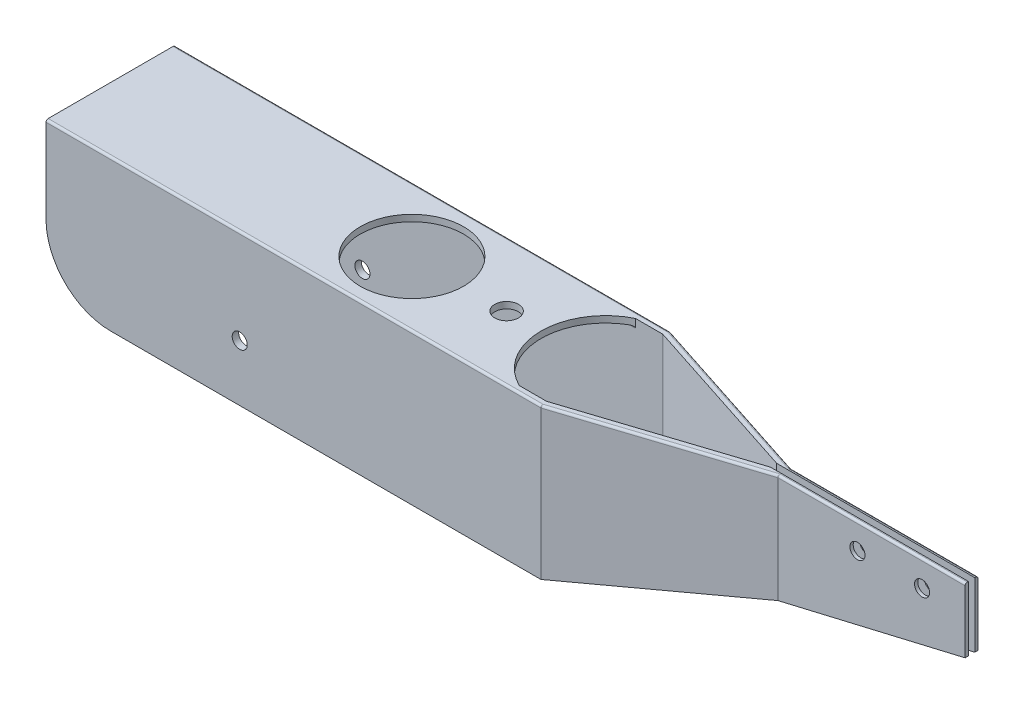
SolidWorks part; units mm, degrees
ref_plane "Front Plane" through (0, 0, 0) normal (0, 0, 1) x (1, 0, 0)
ref_plane "Top Plane" through (0, 0, 0) normal (0, 1, 0) x (1, 0, 0)
ref_plane "Right Plane" through (0, 0, 0) normal (1, 0, 0) x (0, 0, -1)
sketch "Sketch1" plane through (0, 0, 0) normal (0, 1, 0) x (1, 0, 0)
  line L1 (0, 0) -> (200, 0)
  line L2 (0, 0) -> (0, 30)
  line L3 (0, 30) -> (200, 30)
  line L4 (200, 0) -> (200, 30)
  dimension "D1" = 30
  dimension "D2" = 200
extrude "Extrude1" add sketch "Sketch1" along normal blind 35
sketch "Sketch2" plane through (0, 35, 0) normal (0, 1, 0) x (-1, 0, 0)
  line L0 (-200, -13.5) -> (0, -13.5) construction
  line L1 (-200, -13.5) -> (-156.5487, -13.5)
  line L2 (-115, 0) -> (-200, 0)
  line L3 (-115, 0) -> (-156.5487, -13.5)
  line L4 (-200, -15) -> (0, -15) construction
  line L5 (0, -30) -> (0, 0) construction
  line L6 (0, 0) -> (-200, 0) construction
  line L7 (-200, 0) -> (-200, -13.5)
  line L8 (-115, -30) -> (-200, -30)
  line L9 (-200, -30) -> (-200, -16.5)
  line L10 (-200, -16.5) -> (-156.5487, -16.5)
  line L11 (-115, -30) -> (-156.5487, -16.5)
  dimension "D1" = 18
extrude "Cut-Extrude1" cut sketch "Sketch2" against normal blind 35
shell "Shell1" thickness 1.5
fillet "Fillet1" radius 15 2 edges at (0, 0, -0.75) (0, 0, -29.25)
sketch "Sketch3" plane through (0, 35, 0) normal (0, 1, 0) x (-1, 0, 0)
  line L0 (-115, -30) -> (-115, 0) construction
  line L1 (0, 0) -> (-115, 0) construction
  line L2 (-200, -15.01) -> (-200, -14.99)
  line L5 (-114.7624, -28.5) -> (-156.2804, -15.01)
  line L6 (-114.7624, -1.5) -> (-156.2804, -14.99)
  line L9 (-200, -15.01) -> (-156.2804, -15.01)
  line L10 (-114.7624, -28.5) -> (-108.4617, -28.5)
  line L11 (-114.7624, -1.5) -> (-108.4617, -1.5)
  line L12 (-200, -14.99) -> (-156.2804, -14.99)
  arc A0 (-108.4617, -28.5) -> (-108.4617, -1.5) centre (-115, -15) ccw
extrude "Cut-Extrude2" cut sketch "Sketch3" against normal blind 35
sketch "Sketch4" plane through (0, 35, 0) normal (0, 1, 0) x (-1, 0, 0)
  circle A0 centre (-70, -15) radius 12
  circle A1 centre (-92, -15) radius 2.75
extrude "Cut-Extrude3" cut sketch "Sketch4" against normal blind 35
sketch "Sketch5" plane through (0, 0, 0) normal (0, 0, 1) x (1, 0, 0)
  line L0 (15, 0) -> (115, 0) construction
  circle A0 centre (45, 13.07) radius 1.75
  dimension "D1" = 13.07
extrude "Cut-Extrude4" cut sketch "Sketch5" against normal blind 35
sketch "Sketch6" plane through (0, 0, -13.5) normal (0, 0, 1) x (1, 0, 0)
  circle A0 centre (175, 29) radius 1.75
  circle A1 centre (190, 29) radius 1.75
extrude "Cut-Extrude5" cut sketch "Sketch6" against normal blind 35
fillet "Fillet2" radius 0.5 6 edges at (57.5, 35, 0) (135.7744, 35, -6.75) (178.2744, 35, -13.5) (178.2744, 35, -16.5) (135.7744, 35, -23.25) (57.5, 35, -30)
fillet "Fillet3" radius 0.5 4 edges at (156.5255, 34.8536, -16.3536) (114.9768, 34.8536, -29.8536) (156.5487, 17.25, -16.5) (115, 17.25, -30)
fillet "Fillet4" radius 0.5 4 edges at (156.5255, 34.8536, -13.6464) (114.9768, 34.8536, -0.1464) (156.5487, 17.25, -13.5) (115, 17.25, 0)
fillet "Fillet5" radius 0.5 4 edges at (114.7624, 17.5, -1.5) (54.2308, 33.5, -1.5) (54.2308, 33.5, -28.5) (114.7624, 17.5, -28.5)
fillet "Fillet6" radius 0.5 2 edges at (156.2804, 17.5, -14.99) (156.2804, 17.5, -15.01)
sketch "Sketch7" plane through (0, 35, 0) normal (0, 1, 0) x (-1, 0, 0)
  line L1 (-201.1054, -15.7594) -> (-152.957, -15.7594)
  line L2 (-201.1054, -14.2594) -> (-152.957, -14.2594)
  line L3 (-152.957, -15.7594) -> (-152.957, -14.2594)
  line L4 (-201.1054, -15.7594) -> (-201.1054, -14.2594)
extrude "Cut-Extrude6" cut sketch "Sketch7" against normal through all
sketch "Sketch8" plane through (0, 0, 0) normal (0, 0, 1) x (1, 0, 0)
  line L1 (200, 0) -> (200, 34.5) construction
  line L2 (200, 20) -> (114.9208, 0)
  line L3 (114.9208, 0) -> (200, 0)
  line L4 (200, 0) -> (200, 20)
extrude "Cut-Extrude7" cut sketch "Sketch8" against normal through all
